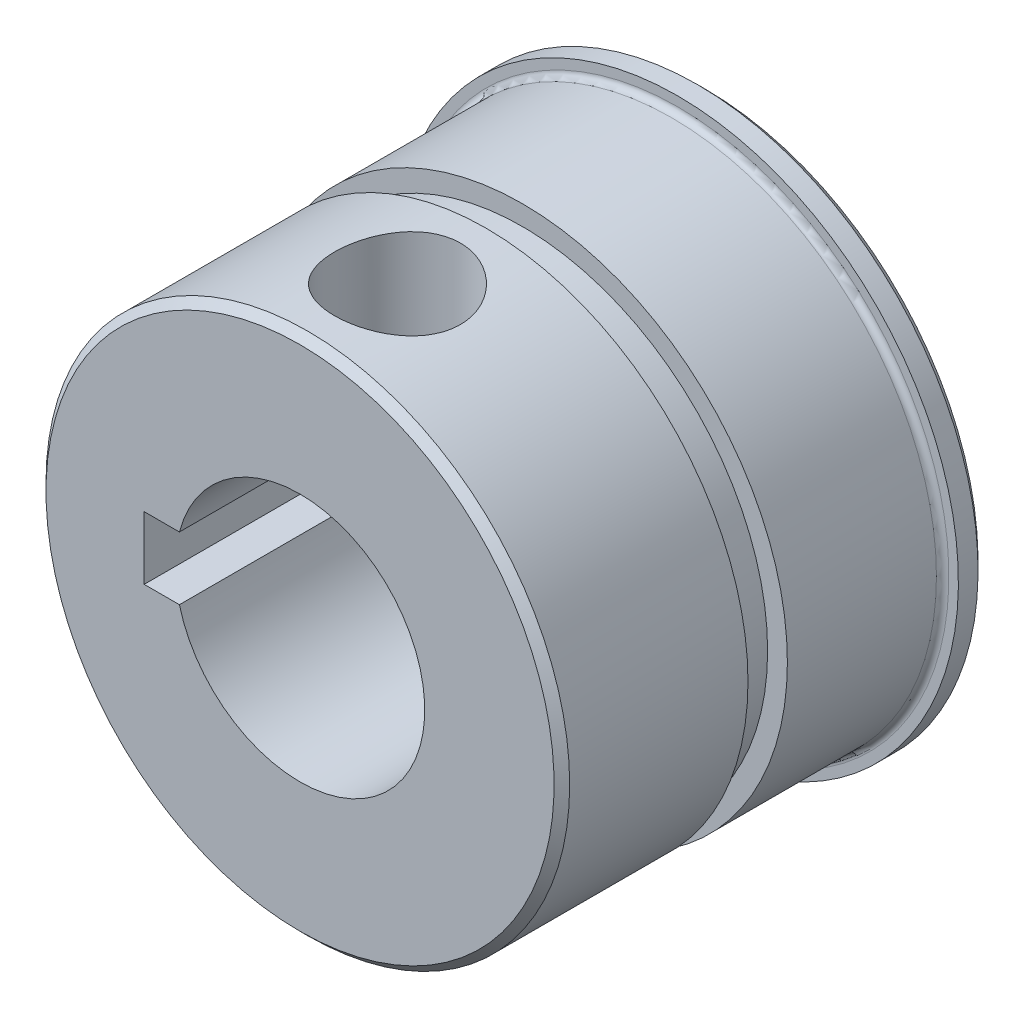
SolidWorks part; units mm, degrees
other "<217-2625-009 Rev1>-<Imported1>"
ref_plane "Front Plane" through (0, 0, 0) normal (0, 0, 1) x (1, 0, 0)
ref_plane "Top Plane" through (0, 0, 0) normal (0, 1, 0) x (1, 0, 0)
ref_plane "Right Plane" through (0, 0, 0) normal (1, 0, 0) x (0, 0, -1)
mirrored part "217-2625-009 Rev1_Mirrored"
